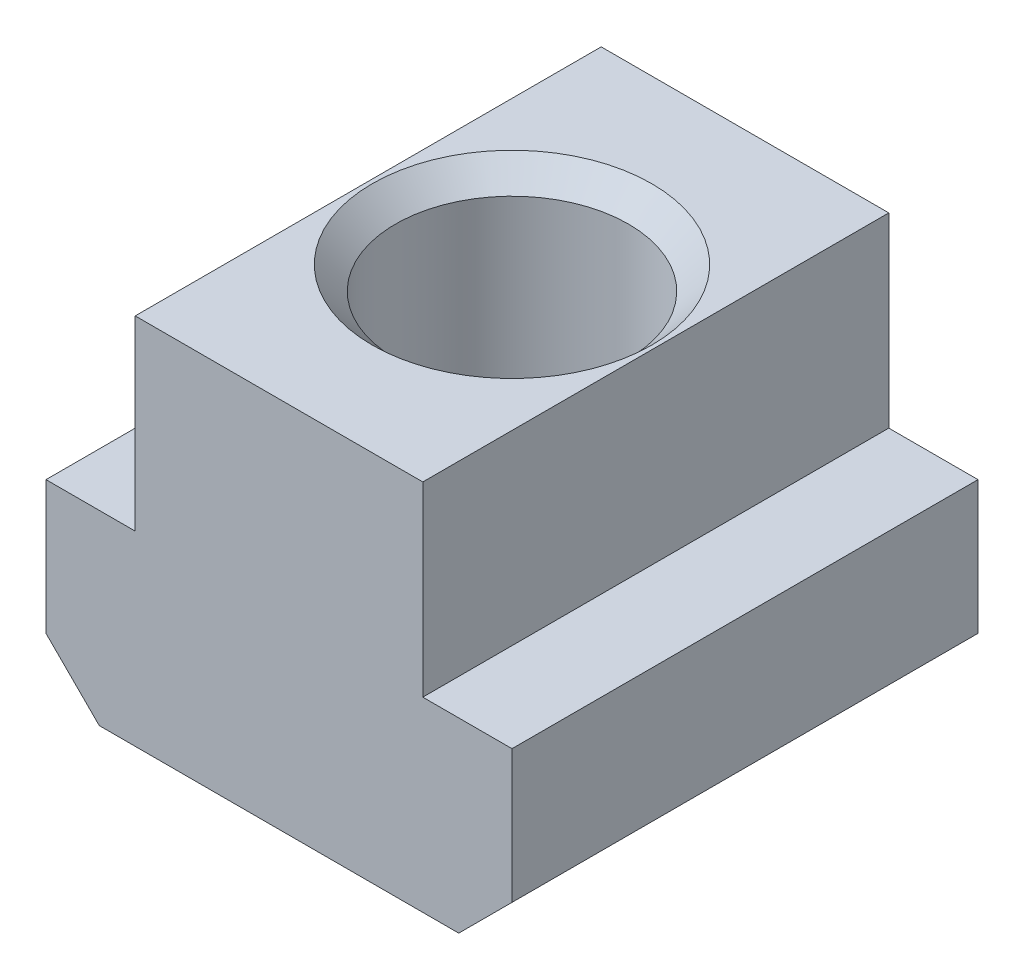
SolidWorks part; units mm, degrees
ref_plane "Plan de face" through (0, 0, 0) normal (0, 0, 1) x (1, 0, 0)
ref_plane "Plan de dessus" through (0, 0, 0) normal (0, 1, 0) x (1, 0, 0)
ref_plane "Plan de droite" through (0, 0, 0) normal (1, 0, 0) x (0, 0, -1)
sketch "Esquisse1" plane through (0, 0, 0) normal (0, 0, 1) x (1, 0, 0)
  line L0 (10.8, 0) -> (17.5, 0)
  line L1 (-17.5, 0) -> (-10.8, 0)
  line L2 (-17.5, 0) -> (-17.5, -14)
  line L3 (-17.5, -14) -> (17.5, -14)
  line L4 (17.5, 0) -> (17.5, -14)
  line L5 (-17.5, 0) -> (17.5, -14) construction
  line L6 (-17.5, -14) -> (17.5, 0) construction
  line L7 (-10.8, 14) -> (10.8, 14)
  line L8 (-10.8, 14) -> (-10.8, 0)
  line L9 (0, 0) -> (0, 18.3915) construction
  line L10 (10.8, 14) -> (10.8, 0)
  line L11 (-10.8, 14) -> (10.8, 0) construction
  line L12 (-10.8, 0) -> (10.8, 14) construction
  point P0 (0, -7)
  point P5 (0, 7)
  dimension "D1" = 21.6
  dimension "D2" = 35
  dimension "D3" = 28
  dimension "D4" = 14
extrude "Boss.-Extru.1" add sketch "Esquisse1" along normal mid plane 35
hole_wizard "Trou taraudé M201" positions "Esquisse3" profile "Esquisse2" tap size "M20" standard "Iso"
sketch "Esquisse3" plane through (0, 14, 0) normal (0, 1, 0) x (1, 0, 0)
  point P0 (0, 0)
sketch "Esquisse2" plane through (0, 14, 0) normal (1, 0, 0) x (0, 0, 1)
  line L0 (0, 0) -> (0, 28)
  line L1 (0, 28) -> (8.75, 28)
  line L2 (8.75, 28) -> (8.75, 1.75)
  line L3 (8.75, 1.75) -> (10.5, 0)
  line L5 (10.5, 0) -> (0, 0)
  line L6 (-8.75, 1.75) -> (-10.5, 0) construction
  line L11 (0, -6.35) -> (0, 107.95) construction
  dimension "Diamètre du trou pour taraudage jusqu'au prochain" = 17.5
  dimension "Profondeur du trou pour taraudage jusqu'au prochain" = 28
  dimension "Diamètre du fraisage entrant" = 21
  dimension "Angle du fraisage entrant" = 90
chamfer "Chanfrein1" distance 4 angle 45 2 edges at (-17.5, -14, 0) (17.5, -14, 0)
